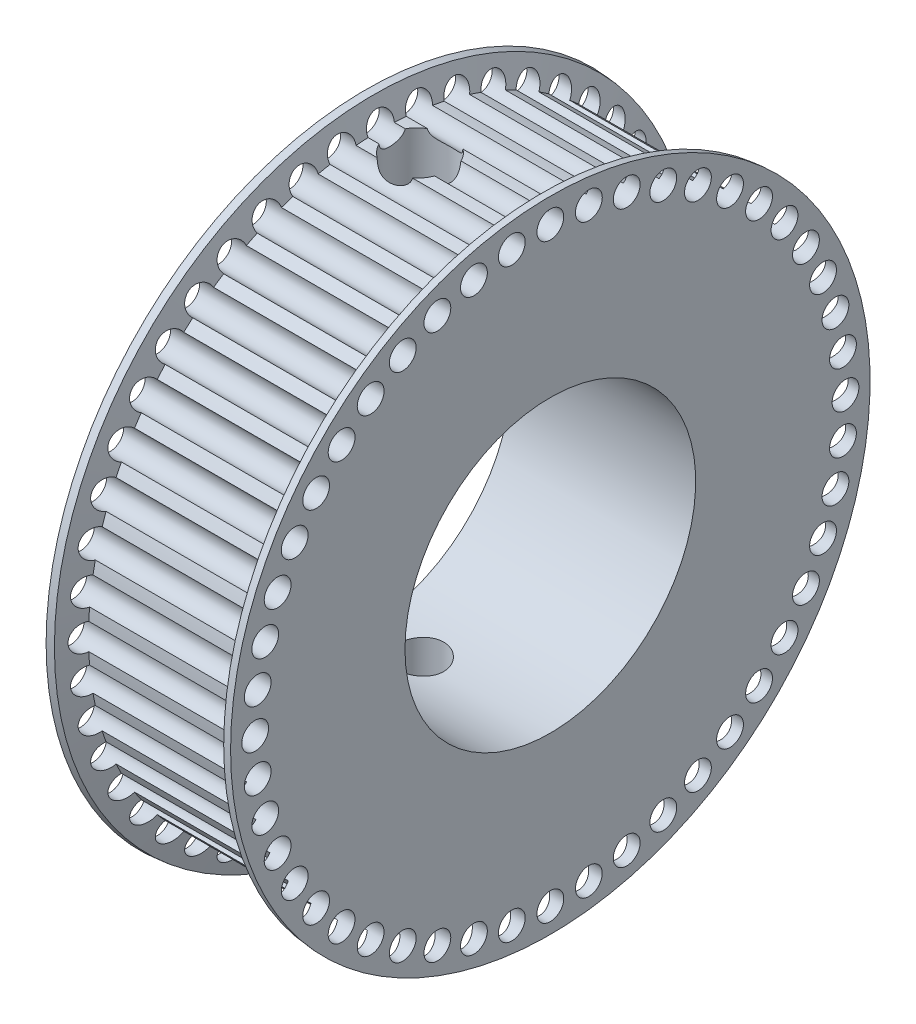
SolidWorks part; units mm, degrees
ref_plane "Front Plane" through (0, 0, 0) normal (0, 0, 1) x (1, 0, 0)
ref_plane "Top Plane" through (0, 0, 0) normal (0, 1, 0) x (1, 0, 0)
ref_plane "Right Plane" through (0, 0, 0) normal (1, 0, 0) x (0, 0, -1)
sketch "Sketch1" plane through (0, 0, 0) normal (0, 0, 1) x (1, 0, 0)
  line L0 (0, 75.6294) -> (0, -50.5482) construction
  line L1 (-51.4164, 0) -> (59.1337, 0) construction
  line L2 (-19.05, 30.0228) -> (19.05, 30.0228)
  line L3 (19.05, 30.0228) -> (19.05, 66.04)
  line L4 (19.05, 66.04) -> (17.4822, 65.8917)
  line L5 (17.4822, 65.8917) -> (15.875, 60.452)
  line L6 (15.875, 60.452) -> (-15.875, 60.452)
  line L7 (0, 60.452) -> (0, 30.0228)
  line L8 (-19.05, 30.0228) -> (-19.05, 66.04)
  line L9 (-19.05, 66.04) -> (-17.4822, 65.8917)
  line L10 (-17.4822, 65.8917) -> (-15.875, 60.452)
  dimension "D1" = 19.05
  dimension "D2" = 30.0228
  dimension "D3" = 66.04
  dimension "D4" = 60.452
  dimension "D5" = 1.5748
  dimension "D6" = 15.875
  dimension "D7" = 73.54
revolve "Revolve2" add sketch "Sketch1" angle 360 about L1
sketch "Sketch3" plane through (19.05, 0, 0) normal (1, 0, 0) x (0, 0, -1)
  circle A0 centre (0, 60.96) radius 2.7686
  dimension "D1" = 5.5372
  dimension "D2" = 60.96
extrude "Cut-Extrude2" cut sketch "Sketch3" against normal through all
pattern_circular "CirPattern1" count 48 over 360 about axis through (0, 0, 0) along (1, 0, 0) of "Cut-Extrude2"
ref_plane "Plane1" through (0, 66.04, 0) normal (0, 1, 0) x (-1, 0, 0)
sketch "Sketch5" plane through (0, 66.04, 0) normal (0, 1, 0) x (-1, 0, 0)
  circle A0 centre (7.9248, 0) radius 3.175
  dimension "D1" = 6.35
  dimension "D2" = 7.9248
extrude "Cut-Extrude3" cut sketch "Sketch5" against normal through all
sketch "Sketch6" plane through (0, 66.04, 0) normal (0, 1, 0) x (-1, 0, 0)
  circle A0 centre (7.874, 0) radius 4.8895
  dimension "D1" = 9.779
  dimension "D2" = 7.874
extrude "Cut-Extrude4" cut sketch "Sketch6" against normal blind 120.65
sketch "Sketch8" plane through (0, 66.04, 0) normal (0, 1, 0) x (-1, 0, 0)
  circle A0 centre (7.874, 0) radius 6.35
  dimension "D1" = 12.7
  dimension "D2" = 7.874
extrude "Cut-Extrude5" cut sketch "Sketch8" against normal blind 19.05
